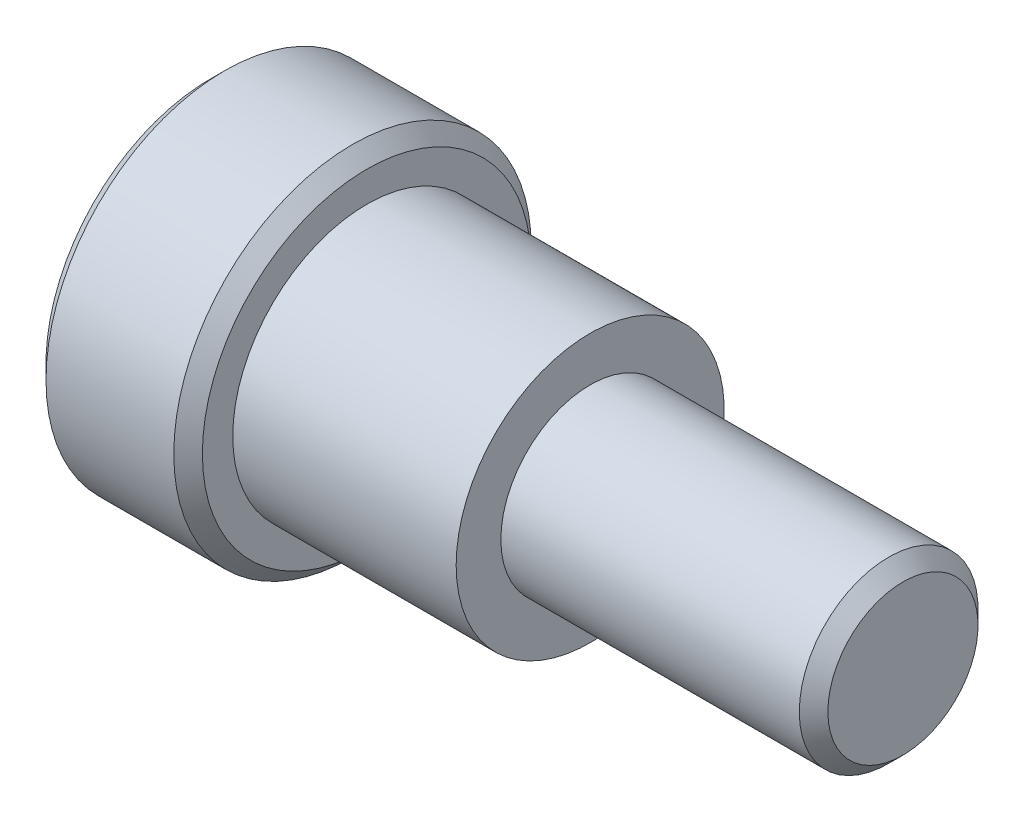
SolidWorks part; units mm, degrees
ref_plane "Plane1" through (0, 0, 0) normal (0, 0, 1) x (1, 0, 0)
ref_plane "Plane2" through (0, 0, 0) normal (0, 1, 0) x (1, 0, 0)
ref_plane "Plane3" through (0, 0, 0) normal (1, 0, 0) x (0, 0, -1)
sketch "Sketch1" plane through (0, 0, 0) normal (0, 0, 1) x (1, 0, 0)
  line L0 (0, 0) -> (27.8396, 0) construction
  line L1 (0, 6.35) -> (5.5562, 6.35)
  line L2 (5.5562, 6.35) -> (5.5562, 4.7625)
  line L3 (5.5562, 4.7625) -> (13.4938, 4.7625)
  line L4 (13.4938, 4.7625) -> (13.4938, 3.175)
  line L5 (13.4938, 3.175) -> (24.6063, 3.175)
  line L6 (24.6063, 3.175) -> (24.6063, 0)
  line L7 (0, 6.35) -> (0, 0)
  line L8 (0, 0) -> (24.6063, 0)
  dimension "D1" = 3.175
  dimension "D2" = 4.7625
  dimension "D3" = 6.35
  dimension "D4" = 5.5562
  dimension "D5" = 7.9375
  dimension "D6" = 11.1125
revolve "Base-Revolve" add sketch "Sketch1" angle 360 about L0
chamfer "Chamfer1" distance 0.508 angle 45 3 edges at (24.6063, 0, 3.175) (5.5562, 0, 6.35) (0, 0, 6.35)
sketch "Hexagon - circumscribed1" plane through (0, 0.0261, -0.0261) normal (-1, 0, 0) x (0, 0, 1)
  line L0 (-1.1196, 1.9583) -> (1.1717, 1.9583)
  line L1 (1.1717, 1.9583) -> (2.3174, -0.0261)
  line L2 (2.3174, -0.0261) -> (1.1717, -2.0104)
  line L3 (1.1717, -2.0104) -> (-1.1196, -2.0104)
  line L4 (-1.1196, -2.0104) -> (-2.2653, -0.0261)
  line L5 (-2.2653, -0.0261) -> (-1.1196, 1.9583)
  circle A0 centre (0.0261, -0.0261) radius 1.9844 construction
  circle A1 centre (0.0261, -0.0261) radius 5.842 construction
  dimension "D1" = 3.9688
extrude "Cut-Extrude1" cut sketch "Hexagon - circumscribed1" against normal blind 4.7752
